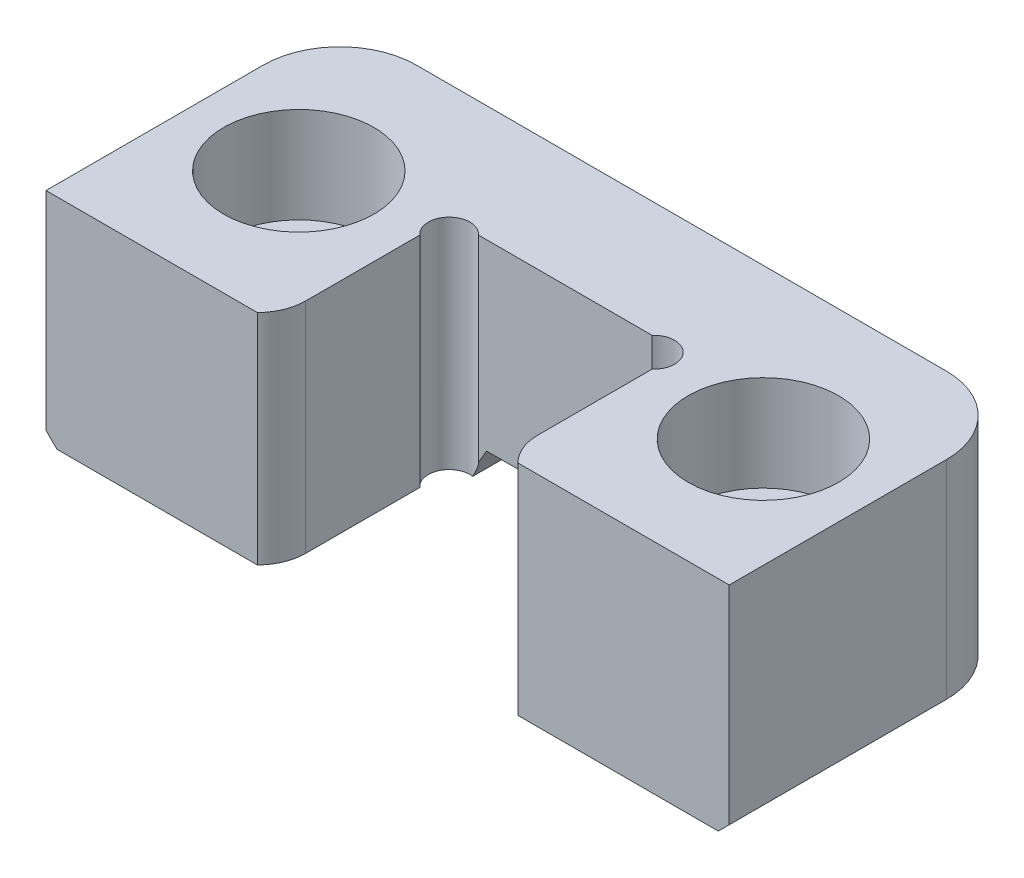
SolidWorks part; units mm, degrees
ref_plane "Front Plane" through (0, 0, 0) normal (0, 0, 1) x (1, 0, 0)
ref_plane "Top Plane" through (0, 0, 0) normal (0, 1, 0) x (1, 0, 0)
ref_plane "Right Plane" through (0, 0, 0) normal (1, 0, 0) x (0, 0, -1)
sketch "Sketch1" plane through (0, 0, 0) normal (0, 1, 0) x (1, 0, 0)
  line L0 (0, 0) -> (0, 50000) construction
  line L1 (0, 0) -> (50000, 0) construction
  line L2 (8.499, 0) -> (25, 0)
  line L3 (-25, 0) -> (-8.499, 0)
  line L4 (-25, 0) -> (-25, 21.5)
  line L5 (-25, 21.5) -> (25, 21.5)
  line L6 (25, 0) -> (25, 21.5)
  line L8 (-8.499, 0) -> (-8.499, 13)
  line L9 (-8.499, 13) -> (8.499, 13)
  line L10 (8.499, 0) -> (8.499, 13)
  dimension "D1" = 21.5
  dimension "D2" = 50
  dimension "D3" = 16.998
  dimension "D4" = 13
extrude "Boss-Extrude1" add sketch "Sketch1" against normal blind 16 separate body
fillet "Fillet1" radius 5.6 2 edges at (25, -8, -21.5) (-25, -8, -21.5)
sketch "Sketch2" plane through (0, 0, 0) normal (0, 1, 0) x (1, 0, 0)
  line L0 (0, 0) -> (0, 50000) construction
  line L1 (-8.499, 0) -> (-8.499, 13) construction
  line L2 (-25, 0) -> (-8.499, 0) construction
  line L3 (-8.499, 2.5) -> (-8.499, 12.7)
  line L4 (-14.849, 0) -> (-9.5367, 0)
  line L5 (14.849, 0) -> (14.849, -12.7)
  line L6 (-14.849, -12.7) -> (14.849, -12.7)
  line L7 (-8.499, 12.7) -> (8.499, 12.7)
  line L8 (-14.849, 0) -> (-14.849, -12.7)
  line L9 (14.849, 0) -> (9.5367, 0)
  line L10 (8.499, 2.5) -> (8.499, 12.7)
  arc A0 (-8.8145, 0.5234) -> (-9.5367, 0) centre (-9.5367, 0.76) cw construction
  arc A1 (8.8145, 0.5234) -> (8.499, 2.5) centre (14.849, 2.5) cw construction
  arc A2 (-8.8145, 0.5234) -> (-8.499, 2.5) centre (-14.849, 2.5) ccw construction
  arc A3 (8.8145, 0.5234) -> (9.5367, 0) centre (9.5367, 0.76) ccw construction
  arc A4 (9.5367, 0) -> (8.499, 2.5) centre (12.0293, 2.5) cw
  arc A5 (-9.5367, 0) -> (-8.499, 2.5) centre (-12.0293, 2.5) ccw
  point P14 (0, -12.7)
  point P24 (0, 12.7)
  dimension "D1" = 0.76
  dimension "D2" = 6.35
  dimension "D3" = 2.5
  dimension "D4" = 12.7
  dimension "D5" = 12.7
extrude "Cut-Extrude1" cut sketch "Sketch2" against normal through all
sketch "Sketch3" plane through (0, 0, 0) normal (0, 1, 0) x (1, 0, 0)
  line L2 (-9.009, 2.5) -> (-9.009, 13)
  line L3 (-9.009, 2.5) -> (-9.009, 13) construction
  line L4 (0, 0) -> (0, 50000) construction
  line L5 (-8.499, 13.51) -> (8.499, 13.51)
  line L6 (-8.499, 13.51) -> (8.499, 13.51) construction
  circle A0 centre (-7.489, 11.99) radius 1.52
  circle A1 centre (7.489, 11.99) radius 1.52
  dimension "D3" = 1.52
  dimension "D1" = 0.51
  dimension "D2" = 0.51
extrude "Cut-Extrude2" cut sketch "Sketch3" against normal through all
sketch "Sketch5" plane through (0, 0, -21.5) normal (0, 0, -1) x (-1, 0, 0)
  line L0 (-6.35, -14.41) -> (6.35, -14.41)
  line L1 (-19.4, 0) -> (19.4, 0) construction
  line L2 (0, 0) -> (0, 50000) construction
  line L3 (6.35, -14.41) -> (7.268, -16)
  line L4 (-19.4, -16) -> (19.4, -16) construction
  line L5 (-7.268, -16) -> (7.268, -16)
  line L6 (-6.35, -14.41) -> (-7.268, -16)
  point P4 (0, 0)
  point P12 (0, -16)
  point P13 (0, -14.41)
  dimension "D1" = 30
  dimension "D2" = 1.59
  dimension "D3" = 12.7
extrude "Cut-Extrude3" cut sketch "Sketch5" against normal through all
chamfer "Chamfer5" distance 3.8 angle 15 1 edges at (0, -14.41, -13)
hole_wizard "CBORE for M6 SHCS1" positions "Sketch7" profile "Sketch6" counterbore size "M6" standard "Ansi Metric"
sketch "Sketch7" plane through (0, 0, 0) normal (0, 1, 0) x (-1, 0, 0)
  line L0 (0, 0) -> (0, 50000) construction
  line L1 (-19.4, -21.5) -> (19.4, -21.5) construction
  line L2 (-25, 0) -> (-25, -15.9) construction
  point P0 (-17, -10.5)
  point P7 (17, -10.5)
  dimension "D1" = 11
  dimension "D2" = 8
sketch "Sketch6" plane through (17, 0, -10.5) normal (1, 0, 0) x (0, 0, 1)
  line L0 (0, 0) -> (0, 16)
  line L1 (0, 16) -> (3.3, 16)
  line L3 (3.3, 16) -> (3.3, 7)
  line L4 (3.3, 7) -> (5.5, 7)
  line L5 (5.5, 7) -> (5.5, 0)
  line L7 (5.5, 0) -> (0, 0)
  line L11 (0, -6.35) -> (0, 107.95) construction
  dimension "Thru Hole Dia." = 6.6
  dimension "Thru Hole Depth" = 16
  dimension "C'Bore Dia." = 11
  dimension "C'Bore Depth" = 7
chamfer "Chamfer6" distance 0.8 angle 45 6 edges at (13.334, -16, -21.5) (23.3598, -16, -19.8598) (25, -16, -7.95) (-13.334, -16, -21.5) (-23.3598, -16, -19.8598) (-25, -16, -7.95)
